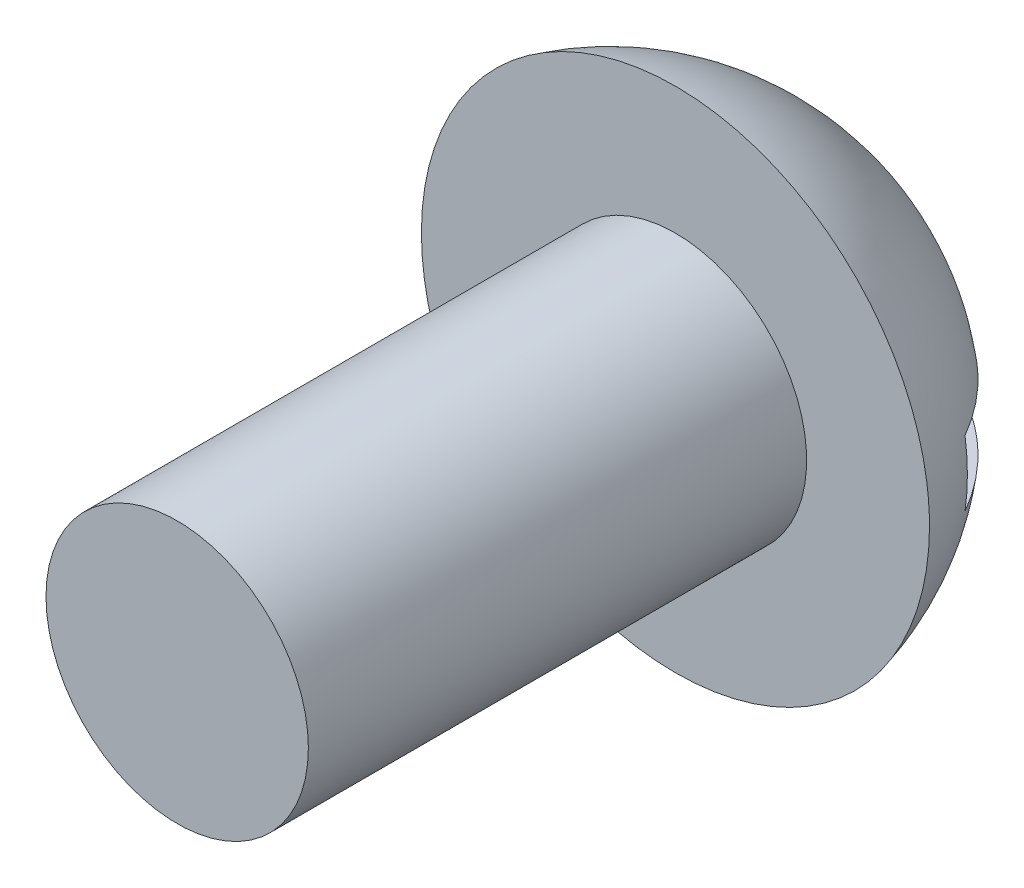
SolidWorks part; units mm, degrees
ref_plane "Plane1" through (0, 0, 0) normal (0, 0, 1) x (1, 0, 0)
ref_plane "Plane2" through (0, 0, 0) normal (0, 1, 0) x (1, 0, 0)
ref_plane "Plane3" through (0, 0, 0) normal (1, 0, 0) x (0, 0, -1)
sketch "Sketch1" plane through (0, 0, 0) normal (1, 0, 0) x (0, 0, -1)
  line L0 (-22.86, 15.2822) -> (-20.974, 15.2822)
  line L1 (-28.5941, 15.2822) -> (6.9659, 15.2822) construction
  line L2 (-22.86, 17.7169) -> (-22.86, 15.2822)
  arc A0 (-20.974, 15.2822) -> (-22.86, 17.7169) centre (-23.4886, 15.2822) ccw
  dimension "D2" = 2.5146
  dimension "D1" = 1.886
revolve "Base-Revolve" add sketch "Sketch1" angle 360 about L1
sketch "Sketch2" plane through (0, 0, 22.86) normal (0, 0, 1) x (1, 0, 0)
  circle A0 centre (0, 15.24) radius 1.2573
  dimension "D1" = 2.5146
extrude "Boss-Extrude1" add sketch "Sketch2" along normal blind 4.7752
sketch "Sketch4" plane through (0, 0, 0) normal (1, 0, 0) x (0, 0, -1)
  line L2 (-22.2511, 14.9678) -> (-20.9938, 14.9678)
  line L3 (-22.2511, 15.5965) -> (-20.9938, 15.5965)
  line L4 (-22.2511, 15.5965) -> (-22.2511, 14.9678)
  arc A1 (-22.86, 12.8474) -> (-22.86, 17.7169) centre (-23.4886, 15.2822) ccw construction
  arc A2 (-20.9938, 14.9678) -> (-20.9938, 15.5965) centre (-23.4886, 15.2822) ccw
  dimension "D1" = 1.2573
  dimension "D2" = 0.6287
  dimension "D3" = 0.3143
extrude "Cut-Extrude1" cut sketch "Sketch4" against normal through all
mirror "Mirror1" about plane through (0, 15.2822, 23.4886) normal (1, 0, 0) of "Cut-Extrude1"
equation "\"D1@Sketch1\"=(3/4)*\"D1@Sketch2\""
equation "\"D2@Sketch1\"=\"D1@Sketch2\""
equation "\"D1@Sketch4\"=.5*\"D1@Sketch2\""
equation "\"D2@Sketch4\"=.25*\"D1@Sketch2\""
equation "\"D3@Sketch4\"=(1/8)*\"D1@Sketch2\""
